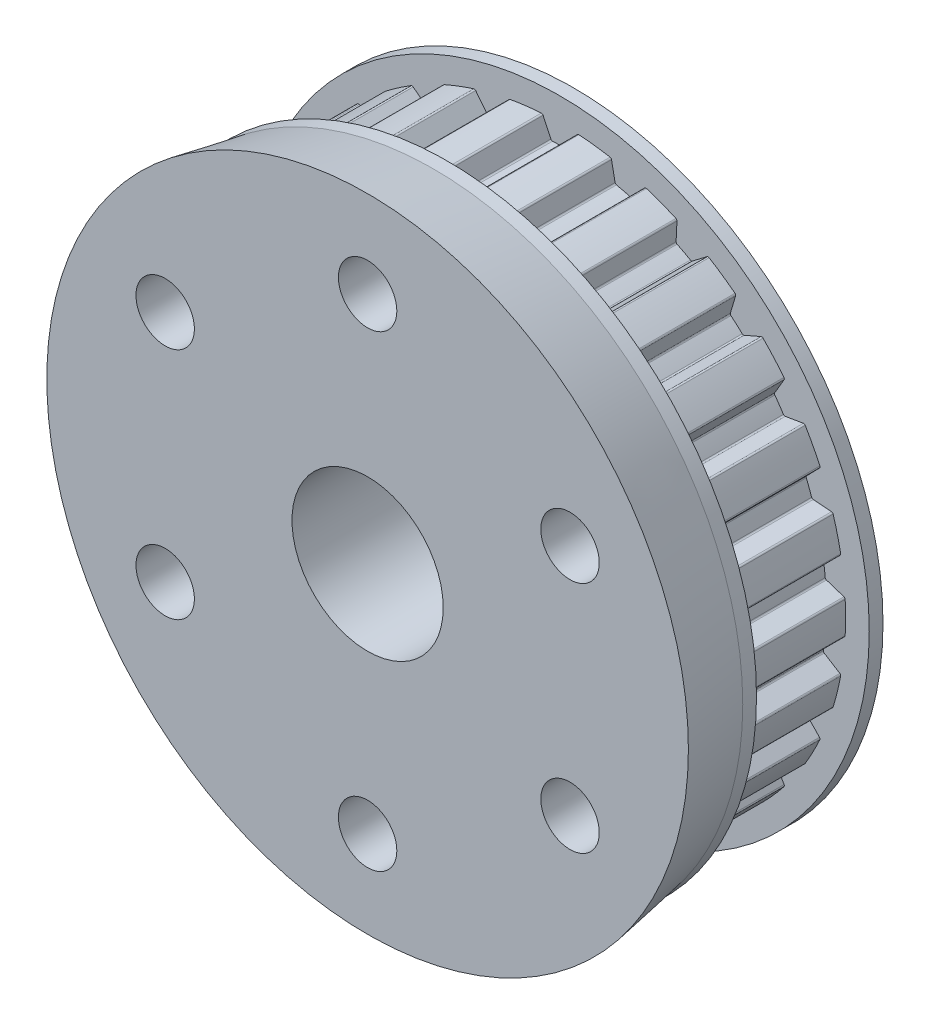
SolidWorks part; units mm, degrees
ref_plane "Front Plane" through (0, 0, 0) normal (0, 0, 1) x (1, 0, 0)
ref_plane "Top Plane" through (0, 0, 0) normal (0, 1, 0) x (1, 0, 0)
ref_plane "Right Plane" through (0, 0, 0) normal (1, 0, 0) x (0, 0, -1)
other "Tabla de configuración"
sketch "Sketch1" plane through (0, 0, 0) normal (0, 0, 1) x (1, 0, 0)
  circle A0 centre (0, 0) radius 20.765
  dimension "D1" = 41.53
extrude "Boss-Extrude1" add sketch "Sketch1" along normal blind 8.2
sketch "Sketch2" plane through (0, 0, 8.2) normal (0, 0, 1) x (1, 0, 0)
  line L0 (0, 20.765) -> (0, 5.2475) construction
  line L1 (-1.2744, 20.7259) -> (-0.6712, 19.4322)
  line L2 (1.2744, 20.7259) -> (0.6712, 19.4322)
  arc A0 (0.5497, 19.3572) -> (-0.5497, 19.3572) centre (0, 0) ccw
  circle A1 centre (0, 0) radius 20.765 construction
  arc A2 (1.2744, 20.7259) -> (-1.2744, 20.7259) centre (0, 0) ccw
  arc A3 (0.6712, 19.4322) -> (0.5497, 19.3572) centre (0.5534, 19.4871) cw
  arc A4 (-0.5497, 19.3572) -> (-0.6712, 19.4322) centre (-0.5534, 19.4871) cw
  point P13 (0.635, 19.3546)
  point P16 (-0.635, 19.3546)
  dimension "D1" = 1.4
  dimension "D4" = 0.13
  dimension "D2" = 50
  dimension "D3" = 1.27
extrude "Cut-Extrude1" cut sketch "Sketch2" against normal up to next
fillet "Fillet1" radius 0.13 2 edges at (1.2744, 20.7259, 4.1) (-1.2744, 20.7259, 4.1)
pattern_circular "CirPattern1" count 26 over 360 about axis through (0, 0, 0) along (0, 0, 1) of "Fillet1", "Cut-Extrude1"
ref_plane "Plano1" through (0, 0, 4.1) normal (0, 0, 1) x (1, 0, 0)
sketch "Croquis1" plane through (0, 0, 8.2) normal (0, 0, 1) x (1, 0, 0)
  circle A0 centre (0, 0) radius 22.485
  dimension "D1" = 44.97
extrude "Saliente-Extruir1" add sketch "Croquis1" along normal blind 1
mirror "Simetría1" about plane through (0, 0, 4.1) normal (0, 0, 1) of "Saliente-Extruir1"
sketch "Croquis4" plane through (0, 0, 9.2) normal (0, 0, 1) x (1, 0, 0)
  circle A1 centre (0, 0) radius 22.485
  circle A2 centre (0, 0) radius 22.485
  dimension "D1" = 0
extrude "Saliente-Extruir2" add sketch "Croquis4" along normal blind 4.8 draft 10
sketch "Croquis2" plane through (0, 0, 0) normal (0, 0, 1) x (1, 0, 0)
  circle A0 centre (0, 0) radius 5.5
  dimension "D1" = 11
extrude "Cortar-Extruir1" cut sketch "Croquis2" against normal through all and the other way through all
sketch "Croquis3" plane through (0, 0, 0) normal (0, 0, 1) x (1, 0, 0)
  circle A0 centre (0, 0) radius 17 construction
  circle A1 centre (0, 17) radius 2.125
  circle A2 centre (14.7224, 8.5) radius 2.125
  circle A3 centre (14.7224, -8.5) radius 2.125
  circle A4 centre (0, -17) radius 2.125
  circle A5 centre (-14.7224, -8.5) radius 2.125
  circle A6 centre (-14.7224, 8.5) radius 2.125
  point P17 (0, 0)
  dimension "D1" = 4.25
  dimension "D2" = 34
  dimension "D3" = 6
extrude "Cortar-Extruir2" cut sketch "Croquis3" against normal through all and the other way through all
